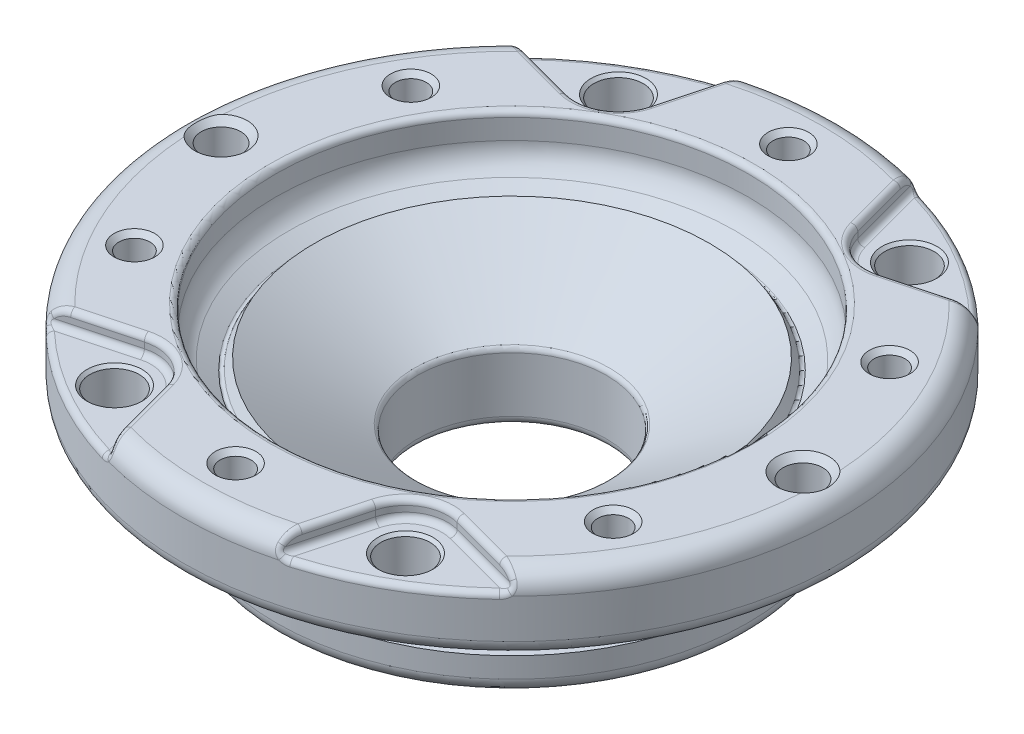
SolidWorks part; units mm, degrees
ref_plane "Front Plane" through (0, 0, 0) normal (0, 0, 1) x (1, 0, 0)
ref_plane "Top Plane" through (0, 0, 0) normal (0, 1, 0) x (1, 0, 0)
ref_plane "Right Plane" through (0, 0, 0) normal (1, 0, 0) x (0, 0, -1)
sketch "Sketch1" plane through (0, 0, 0) normal (1, 0, 0) x (0, 0, -1)
  line L0 (0, 0) -> (0, 47.2033) construction
  line L1 (8.255, 0) -> (20.5867, 0)
  line L2 (20.5867, 0) -> (20.5867, 3.048)
  line L3 (20.5867, 8.636) -> (28.7655, 8.636)
  line L4 (28.7655, 8.636) -> (28.7655, 15.113)
  line L5 (28.7655, 15.113) -> (20.6375, 15.113)
  line L6 (20.6375, 15.113) -> (20.6375, 11.539)
  line L7 (17.2514, 11.0505) -> (8.255, 5.8564)
  line L9 (8.89, 6.223) -> (0, 6.223) construction
  line L10 (17.2514, 11.0505) -> (17.8864, 9.9506)
  line L11 (17.8864, 9.9506) -> (20.6375, 11.539)
  line L12 (17.2514, 11.0505) -> (20.6375, 13.0054) construction
  line L13 (20.5867, 3.048) -> (18.5547, 3.048)
  line L14 (18.5547, 3.048) -> (18.5547, 6.1259)
  line L15 (18.5547, 6.1259) -> (20.5867, 6.1259)
  line L16 (20.5867, 6.1259) -> (20.5867, 8.636)
  line L17 (0, 3.937) -> (8.5315, 6.223) construction
  line L18 (8.5315, 6.223) -> (14.3268, 15.113) construction
  line L19 (14.3268, 15.113) -> (32.7253, 32.5726) construction
  line L20 (24.384, 4.9063) -> (24.384, 14.4462) construction
  line L21 (26.1366, 4.5861) -> (26.1366, 14.4462) construction
  line L22 (22.6314, 4.9063) -> (22.6314, 14.4462) construction
  line L23 (19.8111, 11.0619) -> (19.1761, 12.1617) construction
  line L24 (24.384, 4.9063) -> (24.384, 14.4462) construction
  line L25 (19.1761, 12.1617) -> (20.6375, 13.0054) construction
  line L26 (26.1366, 4.9063) -> (26.1366, 14.4462) construction
  line L28 (8.255, 0) -> (8.255, 5.8564)
  circle A0 centre (18.2118, 11.165) radius 0.889 construction
  circle A1 centre (0, -26.628) radius 44.45 construction
  point P17 (17.3228, 11.165)
  dimension "D9" = 1.778
  dimension "D12" = 88.9
  dimension "D1" = 41.1734
  dimension "D4" = 60
  dimension "D5" = 8.89
  dimension "D6" = 16.51
  dimension "D7" = 1.27
  dimension "D8" = 3.1767
  dimension "D10" = 34.6456
  dimension "D11" = 2.1076
  dimension "D13" = 3.048
  dimension "D14" = 3.0779
  dimension "D15" = 8.636
  dimension "D16" = 57.531
  dimension "D17" = 8.1788
  dimension "D18" = 75
  dimension "D19" = 33.1
  dimension "D20" = 46.5
  dimension "D21" = 37.1094
  dimension "D22" = 6.477
  dimension "D25" = 2.032
  dimension "D26" = 2.2225
  dimension "D27" = 48.768
  dimension "D28" = 2.5101
  dimension "D29" = 6.7824
  dimension "D30" = 2.286
  dimension "D31" = 5.7999
  dimension "D32" = 6.223
  dimension "D33" = 17.78
  dimension "D36" = 41.275
  dimension "D23" = 1.7526
  dimension "D24" = 1.7526
revolve "Revolve1" add sketch "Sketch1" angle 360 about L0
sketch "Sketch10" plane through (0, 0, 0) normal (0, -1, 0) x (1, 0, 0)
  circle A0 centre (0, 0) radius 18.5547
  circle A1 centre (0, 0) radius 20.5867 construction
  circle A2 centre (0, 0) radius 20.5867
  dimension "D1" = 2.032
extrude "Boss-Extrude1" [suppressed] add sketch "Sketch10" along normal blind 0.254
fillet "Fillet1" [suppressed] radius 0.762
fillet "Fillet2" radius 0.508 4 edges at (0, 3.048, -18.5547) (0, 6.1259, -18.5547) (0, 15.113, -20.6375) (0, 5.8564, -8.255)
fillet "Fillet3" radius 0.254 1 edges at (0, 9.9506, -17.8864)
fillet "Fillet4" radius 2.286 1 edges at (0, 11.539, -20.6375)
fillet "Fillet5" [suppressed] radius 0.127
fillet "Fillet6" radius 1.778 1 edges at (0, 15.113, -28.7655)
fillet "Fillet7" radius 1.27 1 edges at (0, 8.636, -28.7655)
hole_wizard "CBORE for #8 Socket Head Cap Screw2" positions "Sketch4" profile "Sketch5" counterbore size "#8" standard "ANSI Inch"
sketch "Sketch4" plane through (0, 15.113, 0) normal (0, 1, 0) x (1, 0, 0)
  line L0 (0, 39.8634) -> (0, 0) construction
  line L1 (0, 0) -> (12.7, 21.997) construction
  circle A0 centre (0, 0) radius 25.4 construction
  point P0 (12.7, 21.997)
  point P20 (12.7, -21.997)
  point P21 (-12.7, -21.997)
  point P23 (-12.7, 21.997)
  point P33 (25.4, 0)
  point P34 (-25.4, 0)
  dimension "D2" = 50.8
  dimension "D1" = 30
  dimension "D3" = 6
sketch "Sketch5" plane through (12.7, 15.113, -21.997) normal (1, 0, 0) x (0, 0, 1)
  line L0 (0, 0) -> (0, 15.113)
  line L1 (0, 15.113) -> (2.1526, 15.113)
  line L3 (2.1526, 15.113) -> (2.1527, 1.524)
  line L4 (2.1527, 1.524) -> (3.683, 1.524)
  line L5 (3.683, 1.524) -> (3.683, 0)
  line L7 (3.683, 0) -> (0, 0)
  line L11 (0, -6.35) -> (0, 107.95) construction
  dimension "Thru Hole Dia." = 4.3053
  dimension "Thru Hole Depth" = 15.113
  dimension "C'Bore Dia." = 7.366
  dimension "C'Bore Depth" = 1.524
hole_wizard "#6-32 Tapped Hole1" positions "Sketch6" profile "Sketch7" tap size "#6-32" standard "ANSI Inch"
sketch "Sketch6" plane through (0, 15.113, 0) normal (0, 1, 0) x (1, 0, 0)
  circle A0 centre (0, 0) radius 24.13 construction
  point P0 (0, 24.13)
  point P12 (20.8972, 12.065)
  point P13 (20.8972, -12.065)
  point P14 (0, -24.13)
  point P15 (-20.8972, -12.065)
  point P16 (-20.8972, 12.065)
  dimension "D1" = 48.26
  dimension "D2" = 6
sketch "Sketch7" plane through (0, 15.113, -24.13) normal (1, 0, 0) x (0, 0, 1)
  line L0 (0, 0) -> (0, 6.477)
  line L1 (0, 6.477) -> (1.778, 6.477)
  line L2 (1.3525, 6.0515) -> (1.3525, 0.4254)
  line L3 (1.3525, 0.4254) -> (1.778, 0)
  line L5 (1.778, 0) -> (0, 0)
  line L6 (-1.3525, 0.4254) -> (-1.778, 0) construction
  line L7 (1.778, 6.477) -> (1.3525, 6.0515)
  line L8 (-1.778, 6.477) -> (-1.3526, 6.0515) construction
  line L11 (0, -6.35) -> (0, 107.95) construction
  dimension "Thru Tap Drill Dia." = 2.7051
  dimension "Thru Tap Drill Depth" = 6.477
  dimension "Near C'Sink Dia." = 3.556
  dimension "Near C'Sink Angle" = 90
  dimension "Far C'Sink Dia." = 3.556
  dimension "Far C'Sink Angle" = 90
sketch "Sketch8" plane through (0, 0, 0) normal (1, 0, 0) x (0, 0, -1)
  line L0 (0, 0) -> (0, 32.7646) construction
  line L1 (-26.67, 15.113) -> (-28.7655, 9.3557)
  line L2 (-18.314, 15.113) -> (-24.8929, 15.113) construction
  line L3 (-28.7655, 13.335) -> (-28.7655, 9.906) construction
  line L4 (-28.7655, 9.3557) -> (-28.7655, 18.6908)
  line L5 (-28.7655, 18.6908) -> (-26.67, 15.113)
  line L6 (21.1455, 15.113) -> (-21.1455, 15.113) construction
  dimension "D1" = 53.34
  dimension "D2" = 70
revolve "Cut-Revolve1" [suppressed] cut sketch "Sketch8" angle 360 about L0
fillet "Fillet8" [suppressed] radius 1.27
fillet "Fillet9" [suppressed] radius 2.54
chamfer "Chamfer1" [suppressed] distance 0.508 angle 45
sketch "Sketch9" plane through (0, 13.589, 0) normal (0, 1, 0) x (1, 0, 0)
  line L0 (12.7, 21.997) -> (16.9955, 29.437) construction
  line L1 (9.1425, 21.0438) -> (5.0448, 36.3368)
  line L2 (13.6532, 18.4395) -> (28.9462, 22.5373)
  line L3 (5.0448, 36.3368) -> (28.9462, 22.5373)
  line L6 (9.1425, 21.0438) -> (16.0067, -4.5736) construction
  line L9 (22.7957, 2.6043) -> (33.9909, 13.7995)
  line L12 (22.7957, -2.6043) -> (33.9909, -13.7995)
  line L15 (33.9909, 13.7995) -> (33.9909, -13.7995)
  line L18 (25.4, 0) -> (33.9909, 0) construction
  line L21 (13.6532, -18.4395) -> (28.9462, -22.5373)
  line L24 (9.1425, -21.0438) -> (5.0448, -36.3368)
  line L25 (28.9462, -22.5373) -> (5.0448, -36.3368)
  line L26 (12.7, -21.997) -> (16.9955, -29.437) construction
  line L27 (-9.1425, -21.0438) -> (-5.0448, -36.3368)
  line L28 (-13.6532, -18.4395) -> (-28.9462, -22.5373)
  line L29 (-5.0448, -36.3368) -> (-28.9462, -22.5373)
  line L30 (-12.7, -21.997) -> (-16.9955, -29.437) construction
  line L31 (-22.7957, -2.6043) -> (-33.9909, -13.7995)
  line L32 (-22.7957, 2.6043) -> (-33.9909, 13.7995)
  line L33 (-33.9909, -13.7995) -> (-33.9909, 13.7995)
  line L34 (-25.4, 0) -> (-33.9909, 0) construction
  line L35 (-13.6532, 18.4395) -> (-28.9462, 22.5373)
  line L36 (-9.1425, 21.0438) -> (-5.0448, 36.3368)
  line L37 (-28.9462, 22.5373) -> (-5.0448, 36.3368)
  line L38 (-12.7, 21.997) -> (-16.9955, 29.437) construction
  arc A0 (9.1425, 21.0438) -> (13.6532, 18.4395) centre (12.7, 21.997) ccw
  arc A2 (22.7957, 2.6043) -> (22.7957, -2.6043) centre (25.4, 0) ccw
  arc A17 (13.6532, -18.4395) -> (9.1425, -21.0438) centre (12.7, -21.997) ccw
  arc A18 (-9.1425, -21.0438) -> (-13.6532, -18.4395) centre (-12.7, -21.997) ccw
  arc A19 (-22.7957, -2.6043) -> (-22.7957, 2.6043) centre (-25.4, 0) ccw
  arc A20 (-13.6532, 18.4395) -> (-9.1425, 21.0438) centre (-12.7, 21.997) ccw
  point P13 (32.2047, 0)
  point P16 (-32.2047, 0)
  point P43 (0, 0)
  point P63 (0, 0)
  point P69 (-32.2047, 0)
  point P76 (32.2047, 0)
  point P83 (-32.2047, 0)
  point P90 (32.2047, 0)
  point P97 (-32.2047, 0)
  point P104 (32.2047, 0)
  point P111 (-32.2047, 0)
  point P118 (32.2047, 0)
  point P125 (-32.2047, 0)
  point P132 (32.2047, 0)
  point P139 (-32.2047, 0)
  point P146 (32.2047, 0)
  dimension "D2" = 3.683
  dimension "D1" = 90
  dimension "D3" = 6
extrude "Cut-Extrude1" cut sketch "Sketch9" along normal through all
fillet "Fillet10" radius 0.508 12 edges at (8.2378, 13.589, -24.42) (17.0294, 13.589, -19.3442) (-10.8585, 13.589, -18.8075) (-10.8585, 13.589, 18.8075) (10.8585, 13.589, -18.8075) (10.8585, 13.589, 18.8075) (17.0294, 13.589, 19.3442) (8.2378, 13.589, 24.42) (-8.2378, 13.589, 24.42) (-17.0294, 13.589, 19.3442) (-17.0294, 13.589, -19.3442) (-8.2378, 13.589, -24.42)
chamfer "Chamfer2" [suppressed] distance 0.508 angle 45
fillet "Fillet11" radius 0.508 32 edges at (10.8585, 15.113, 18.8075) (16.0395, 15.113, 19.0789) (18.8322, 15.0766, 19.8272) (7.4713, 14.5504, 27.2806) (-8.5031, 15.113, 23.4301) (-7.7548, 15.0766, 26.2228) (-19.89, 14.5504, 20.1107) (-16.0395, 15.113, 19.0789) (-18.8322, 15.0766, -19.8272) (-7.4713, 14.5504, -27.2806) (-8.5031, 15.113, -23.4301) (-10.8585, 15.113, -18.8075) (8.5031, 15.113, -23.4301) (7.7548, 15.0766, -26.2228) (19.89, 14.5504, -20.1107) (16.0395, 15.113, -19.0789) (8.5031, 15.113, 23.4301) (-10.8585, 15.113, 18.8075) (-16.0395, 15.113, -19.0789) (10.8585, 15.113, -18.8075) (20.2597, 13.7504, 20.3512) (14.3736, 13.589, 24.8959) (7.4561, 13.7959, 27.7194) (-7.4948, 13.7504, 27.721) (-14.3736, 13.589, 24.8959) (-20.2777, 13.7959, 20.3169) (-20.2597, 13.7504, -20.3512) (-14.3736, 13.589, -24.8959) (-7.4561, 13.7959, -27.7194) (7.4948, 13.7504, -27.721) (14.3736, 13.589, -24.8959) (20.2777, 13.7959, -20.3169)
chamfer "Chamfer3" distance 0.254 angle 45 12 edges at (12.7, 13.589, 24.1497) (11.6237, 8.636, 20.1328) (-12.7, 13.589, 24.1497) (-11.6237, 8.636, 20.1328) (-12.7, 13.589, -19.8444) (-11.6237, 8.636, -20.1328) (12.7, 13.589, -19.8444) (11.6237, 8.636, -20.1328)
fillet "Fillet12" [suppressed] radius 0.762
hole_wizard "M2x0.4 Tapped Hole1" positions "Sketch2" profile "Sketch3" tap size "M2x0.4" standard "ANSI Metric"
sketch "Sketch2" plane through (0, 0, 0) normal (0, -1, 0) x (-1, 0, 0)
  line L0 (0, 0) -> (15.5784, 0) construction
  point P0 (10.5, -12.4001)
  point P3 (-10.5, -12.4001)
  point P6 (-10.5, 0.0999)
  point P9 (10.5, 0.0999)
sketch "Sketch3" plane through (-10.5, 0, 12.4001) normal (1, 0, 0) x (0, 0, -1)
  line L0 (0, 0) -> (0, 5.0527)
  line L1 (0, 5.0527) -> (0.8, 4.572)
  line L2 (0.8, 4.572) -> (0.8, 0.225)
  line L3 (0.8, 0.225) -> (1.025, 0)
  line L5 (1.025, 0) -> (0, 0)
  line L6 (-0.8, 0.225) -> (-1.025, 0) construction
  line L10 (0, 5.0527) -> (-0.8, 4.572) construction
  line L11 (0, -6.35) -> (0, 107.95) construction
  dimension "Tap Drill Dia." = 1.6
  dimension "Tap Drill Depth" = 4.572
  dimension "Near C'Sink Dia." = 2.05
  dimension "Near C'Sink Angle" = 90
  dimension "Drill Angle" = 118
sketch "Sketch11" plane through (0, 0, 0) normal (0, -1, 0) x (1, 0, 0)
  line L0 (-18.3793, 0) -> (0, 0) construction
  line L1 (-10.795, 15.24) -> (10.795, 15.24)
  line L2 (-13.335, 12.7) -> (-13.335, -7.7618)
  line L3 (-10.795, -10.3018) -> (10.795, -10.3018)
  line L4 (13.335, 12.7) -> (13.335, -7.7618)
  line L5 (-13.335, 15.24) -> (13.335, -10.3018) construction
  line L6 (-13.335, -10.3018) -> (13.335, 15.24) construction
  line L7 (0, 0) -> (0, 15.4001) construction
  line L8 (-12.5, 2.4691) -> (-17.1301, 2.4691) construction
  line L9 (-12.5, -7.4619) -> (-12.5, 12.4001) construction
  arc A0 (-13.335, -7.7618) -> (-10.795, -10.3018) centre (-10.795, -7.7618) ccw
  circle A1 centre (0, 0) radius 20.5867
  circle A2 centre (0, 0) radius 20.5867
  arc A3 (10.795, -10.3018) -> (13.335, -7.7618) centre (10.795, -7.7618) ccw
  arc A4 (10.795, 15.24) -> (13.335, 12.7) centre (10.795, 12.7) cw
  arc A5 (-10.795, 15.24) -> (-13.335, 12.7) centre (-10.795, 12.7) ccw
  dimension "D4" = 2.54
  dimension "D2" = 26.67
  dimension "D5" = 15.24
  dimension "D1" = 0
extrude "Boss-Extrude2" [suppressed] add sketch "Sketch11" along normal blind 1.6002
fillet "Fillet13" [suppressed] radius 0.762
sketch "Sketch12" [suppressed] plane through (0, 0, 0) normal (0, -1, 0) x (1, 0, 0)
  line L0 (-8.595, 12.4001) -> (-8.595, 15.24)
  line L1 (-10.5, 10.4951) -> (-13.335, 10.4951)
  line L2 (-13.335, 12.7) -> (-13.335, -7.7618) construction
  line L3 (10.795, 15.24) -> (-10.795, 15.24) construction
  line L4 (-8.595, 15.24) -> (-10.795, 15.24)
  line L5 (-13.335, 12.7) -> (-13.335, 10.4951)
  line L6 (0, 0) -> (0, 17.4165) construction
  line L7 (-10.5, 12.4001) -> (-16.2274, 18.1276) construction
  line L8 (10.5, 12.4001) -> (16.2274, 18.1276) construction
  line L9 (13.335, 12.7) -> (13.335, 10.4951)
  line L10 (8.595, 15.24) -> (10.795, 15.24)
  line L11 (10.5, 10.4951) -> (13.335, 10.4951)
  line L12 (8.595, 12.4001) -> (8.595, 15.24)
  line L13 (-10.5, 1.8051) -> (-13.335, 1.8051)
  line L14 (-13.335, 1.8051) -> (-13.335, -2.0049)
  line L15 (-13.335, -2.0049) -> (-10.5, -2.0049)
  line L16 (13.335, -2.0049) -> (10.5, -2.0049)
  line L17 (13.335, 1.8051) -> (13.335, -2.0049)
  line L18 (10.5, 1.8051) -> (13.335, 1.8051)
  arc A0 (-10.5, 10.4951) -> (-8.595, 12.4001) centre (-10.5, 12.4001) ccw
  arc A3 (-10.5, -2.0049) -> (-10.5, 1.8051) centre (-10.5, -0.0999) ccw
  arc A4 (-10.795, 15.24) -> (-13.335, 12.7) centre (-10.795, 12.7) ccw construction
  arc A5 (-10.795, 15.24) -> (-13.335, 12.7) centre (-10.795, 12.7) ccw
  arc A6 (10.795, 15.24) -> (13.335, 12.7) centre (10.795, 12.7) cw
  arc A7 (10.5, -2.0049) -> (10.5, 1.8051) centre (10.5, -0.0999) cw
  arc A8 (10.5, 10.4951) -> (8.595, 12.4001) centre (10.5, 12.4001) cw
  dimension "D1" = 3.81
  dimension "D2" = 45
  dimension "D3" = 90
extrude "Boss-Extrude3" [suppressed] add sketch "Sketch12" along normal up to surface (1.6002 mm away) contours L1 A0 L0 M10 M11 M12 M13 | A3 M16 | A7 M15 | A8 L11 L12 M8 M9 M10 M14
fillet "Fillet14" [suppressed] radius 1.6002
fillet "Fillet15" radius 1.27 1 edges at (0, 0, -20.5867)
fillet "Fillet16" radius 0.762 2 edges at (0, 0, -8.255) (0, 8.636, -20.5867)
hole_wizard "#8-32 Tapped Hole1" positions "Sketch13" profile "Sketch14" tap size "#8-32" standard "ANSI Inch"
sketch "Sketch13" plane through (0, 15.113, 0) normal (0, 1, 0) x (1, 0, 0)
  line L0 (0, 42.2492) -> (0, 0) construction
  line L1 (0, 0) -> (37.8019, 0) construction
  circle A0 centre (0, 0) radius 25.4 construction
  circle A1 centre (0, 0) radius 25.4
  point P0 (25.4, 0)
  point P14 (-25.4, 0)
sketch "Sketch14" plane through (25.4, 15.113, 0) normal (1, 0, 0) x (0, 0, 1)
  line L0 (0, 0) -> (0, 6.477)
  line L1 (0, 6.477) -> (2.286, 6.477)
  line L2 (1.7272, 5.9182) -> (1.7272, 0.5588)
  line L3 (1.7272, 0.5588) -> (2.286, 0)
  line L5 (2.286, 0) -> (0, 0)
  line L6 (-1.7272, 0.5588) -> (-2.286, 0) construction
  line L7 (2.286, 6.477) -> (1.7272, 5.9182)
  line L8 (-2.286, 6.477) -> (-1.7272, 5.9182) construction
  line L11 (0, -6.35) -> (0, 107.95) construction
  dimension "Thru Tap Drill Dia." = 3.4544
  dimension "Thru Tap Drill Depth" = 6.477
  dimension "Near C'Sink Dia." = 4.572
  dimension "Near C'Sink Angle" = 90
  dimension "Far C'Sink Dia." = 4.572
  dimension "Far C'Sink Angle" = 90
